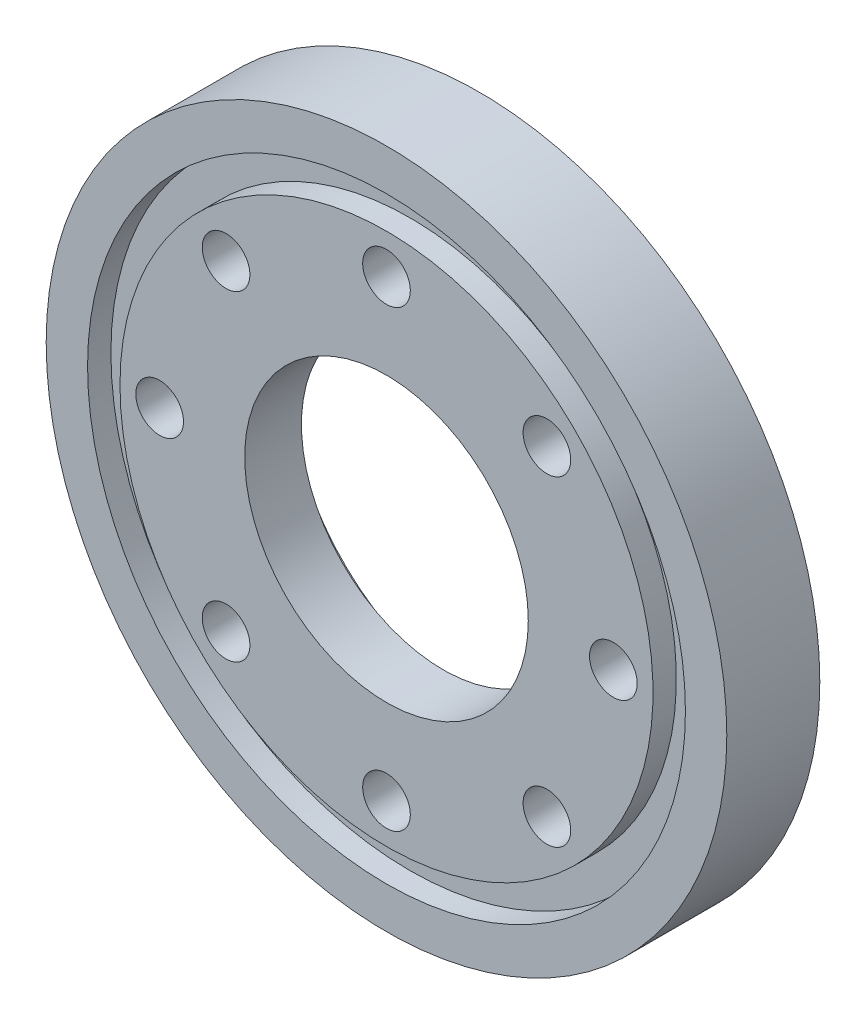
SolidWorks part; units mm, degrees
ref_plane "Front Plane" through (0, 0, 0) normal (0, 0, 1) x (1, 0, 0)
ref_plane "Top Plane" through (0, 0, 0) normal (0, 1, 0) x (1, 0, 0)
ref_plane "Right Plane" through (0, 0, 0) normal (1, 0, 0) x (0, 0, -1)
sketch "Sketch1" plane through (0, 0, 0) normal (0, 0, 1) x (1, 0, 0)
  line L0 (0, 70.6348) -> (0, -65.4026) construction
  line L1 (-79.6604, 0) -> (84.3694, 0) construction
  circle A0 centre (0, 0) radius 12.5
  circle A1 centre (0, 0) radius 30
  dimension "D1" = 60
  dimension "D2" = 25
extrude "Boss-Extrude1" add sketch "Sketch1" along normal blind 5
sketch "Sketch2" plane through (0, 0, 5) normal (0, 0, -1) x (-1, 0, 0)
  line L0 (0, 36.1759) -> (0, -37.0221) construction
  line L1 (-35.2874, 0) -> (36.2182, 0) construction
  circle A0 centre (20, 0) radius 1.7272
  dimension "D1" = 3.4544
  dimension "D2" = 20
extrude "Cut-Extrude1" [suppressed] cut sketch "Sketch2" along normal blind 3.81
pattern_circular "CirPattern1" [suppressed] count 8 over 360
sketch "Sketch3" plane through (0, 0, 5) normal (0, 0, -1) x (-1, 0, 0)
  circle A0 centre (0, 0) radius 23.495
  circle A1 centre (0, 0) radius 26.3525
  dimension "D1" = 52.705
  dimension "D2" = 46.99
extrude "Cut-Extrude2" cut sketch "Sketch3" along normal blind 2.0574
sketch "Sketch4" plane through (0, 0, 0) normal (0, 1, 0) x (1, 0, 0)
  line L0 (-23.495, -5) -> (23.495, -5) construction
  line L2 (-12.6875, -1.8) -> (-13.5375, 0.6)
  line L3 (-13.5375, 0.6) -> (-13.5375, -2.6)
  line L4 (-13.5375, -2.6) -> (-15.0375, -2.6)
  line L5 (-15.0375, -2.6) -> (-15.0375, 0.6)
  line L6 (-15.0375, 0.6) -> (-15.8875, -1.8)
  line L8 (-15.8875, -1.8) -> (-15.8875, -5)
  line L9 (-14.2875, 20.9976) -> (-14.2875, -8.6969) construction
  line L10 (0, 11.985) -> (0, -13.8544) construction
  line L11 (-15.8875, -5) -> (-12.6875, -5)
  line L12 (-12.6875, -5) -> (-12.6875, -1.8)
  dimension "D1" = 14.2875
  dimension "D2" = 1.5
  dimension "D3" = 3.2
  dimension "D4" = 2.4
  dimension "D5" = 3.2
  dimension "D6" = 3.2
  dimension "D7" = 3.2
revolve "Revolve1" add sketch "Sketch4" angle 360 about L10
hole_wizard "M5x0.8 Tapped Hole1" positions "Sketch6" profile "Sketch5" tap size "M5x0.8" standard "Ansi Metric"
sketch "Sketch6" plane through (0, 0, 5) normal (0, 0, 1) x (1, 0, 0)
  line L0 (0, 36.1759) -> (0, -37.0221) construction
  line L1 (35.2874, 0) -> (-36.2182, 0) construction
  point P0 (-20, 0)
  dimension "D1" = 20
sketch "Sketch5" plane through (-20, 0, 5) normal (1, 0, 0) x (0, -1, 0)
  line L0 (0, 0) -> (0, 6.3418)
  line L1 (0, 6.3418) -> (2.1, 5.08)
  line L2 (2.1, 5.08) -> (2.1, 0)
  line L5 (2.1, 0) -> (0, 0)
  line L10 (0, 6.3418) -> (-2.1, 5.08) construction
  line L11 (0, -6.35) -> (0, 107.95) construction
  dimension "Tap Drill Dia." = 4.2
  dimension "Tap Drill Depth" = 5.08
  dimension "Drill Angle" = 118
pattern_circular "CirPattern2" [suppressed] count 8 over 360
sketch "Sketch7" plane through (0, 0, 0) normal (0, 0, -1) x (-1, 0, 0)
  circle A0 centre (0, 0) radius 30
  circle A1 centre (0, 0) radius 15.0375
  circle A2 centre (0, 0) radius 30 construction
  circle A3 centre (0, 0) radius 15.0375 construction
extrude "Boss-Extrude2" [suppressed] add sketch "Sketch7" along normal blind 3.175
sketch "Sketch8" plane through (0, 0, 0) normal (0, 0, -1) x (-1, 0, 0)
  circle A0 centre (0, 0) radius 15.0375
  circle A1 centre (0, 0) radius 13.5375
  circle A2 centre (0, 0) radius 15.0375 construction
  circle A5 centre (0, 0) radius 13.5375 construction
extrude "Cut-Extrude8" cut sketch "Sketch8" against normal blind 3.2
sketch "Sketch9" plane through (0, 0, 0) normal (0, 0, -1) x (-1, 0, 0)
  circle A0 centre (0, 0) radius 30
  circle A1 centre (0, 0) radius 15
  circle A2 centre (0, 0) radius 30 construction
  dimension "D2" = 30
extrude "Boss-Extrude3" add sketch "Sketch9" along normal blind 3.2
sketch "Sketch10" plane through (0, 0, 3.2) normal (0, 0, -1) x (-1, 0, 0)
  circle A0 centre (0, 0) radius 14.9225
  circle A1 centre (0, 0) radius 15.875
  dimension "D1" = 31.75
  dimension "D2" = 29.845
extrude "Boss-Extrude4" [suppressed] add sketch "Sketch10" along normal blind 3.175
sketch "Sketch11" plane through (0, 0, 5) normal (0, 0, 1) x (1, 0, 0)
  circle A0 centre (0, 0) radius 15
  dimension "D1" = 30
hole_wizard "M5x0.8 Tapped Hole2" positions "3DSketch1" profile "Sketch12" tap size "M5x0.8" standard "Ansi Metric"
sketch3d "3DSketch1"
  point P0 (-20, 0, 5)
sketch "Sketch12" plane through (-20, 0, 5) normal (1, 0, 0) x (0, -1, 0)
  line L0 (0, 0) -> (0, 6.2618)
  line L1 (0, 6.2618) -> (2.1, 5)
  line L2 (2.1, 5) -> (2.1, 0)
  line L5 (2.1, 0) -> (0, 0)
  line L10 (0, 6.2618) -> (-2.1, 5) construction
  line L11 (0, -6.35) -> (0, 107.95) construction
  dimension "Tap Drill Dia." = 4.2
  dimension "Tap Drill Depth" = 5
  dimension "Drill Angle" = 118
pattern_circular "CirPattern3" count 8 over 360 about axis through (0, 0, 0) along (0, 0, 1) of "M5x0.8 Tapped Hole2"
sketch "Sketch13" plane through (0, 0, 0) normal (0, 1, 0) x (1, 0, 0)
  line L0 (-30, -5) -> (-20, 3.2)
  line L3 (30, 3.2) -> (-30, 3.2) construction
  line L4 (-20, 3.2) -> (-30, 3.2)
  line L5 (-30, 3.2) -> (-30, -5)
  dimension "D1" = 10
ref_axis "Axis1" through (0, 0, 5) along (0, 0, -1)
revolve "Cut-Revolve1" [suppressed] cut sketch "Sketch13" angle 360 about axis through (0, 0, 5) along (0, 0, -1)
sketch "Sketch14" plane through (0, 0, 0) normal (0, 1, 0) x (1, 0, 0)
  line L0 (15, 3.2) -> (-15, 3.2) construction
  line L1 (14.986, 3.2) -> (16.891, 3.2)
  line L2 (14.986, 3.2) -> (14.986, 0.025)
  line L3 (14.986, 0.025) -> (16.891, 0.025)
  line L4 (16.891, 3.2) -> (16.891, 0.025)
  line L5 (30, 3.2) -> (-30, 3.2) construction
  line L6 (-26.3525, -2.9426) -> (26.3525, -2.9426) construction
  point P8 (0, -2.9426)
  dimension "D1" = 1.905
  dimension "D2" = 3.175
  dimension "D3" = 14.986
revolve "Cut-Revolve2" cut sketch "Sketch14" angle 360 about axis through (0, 0, 5) along (0, 0, -1)
